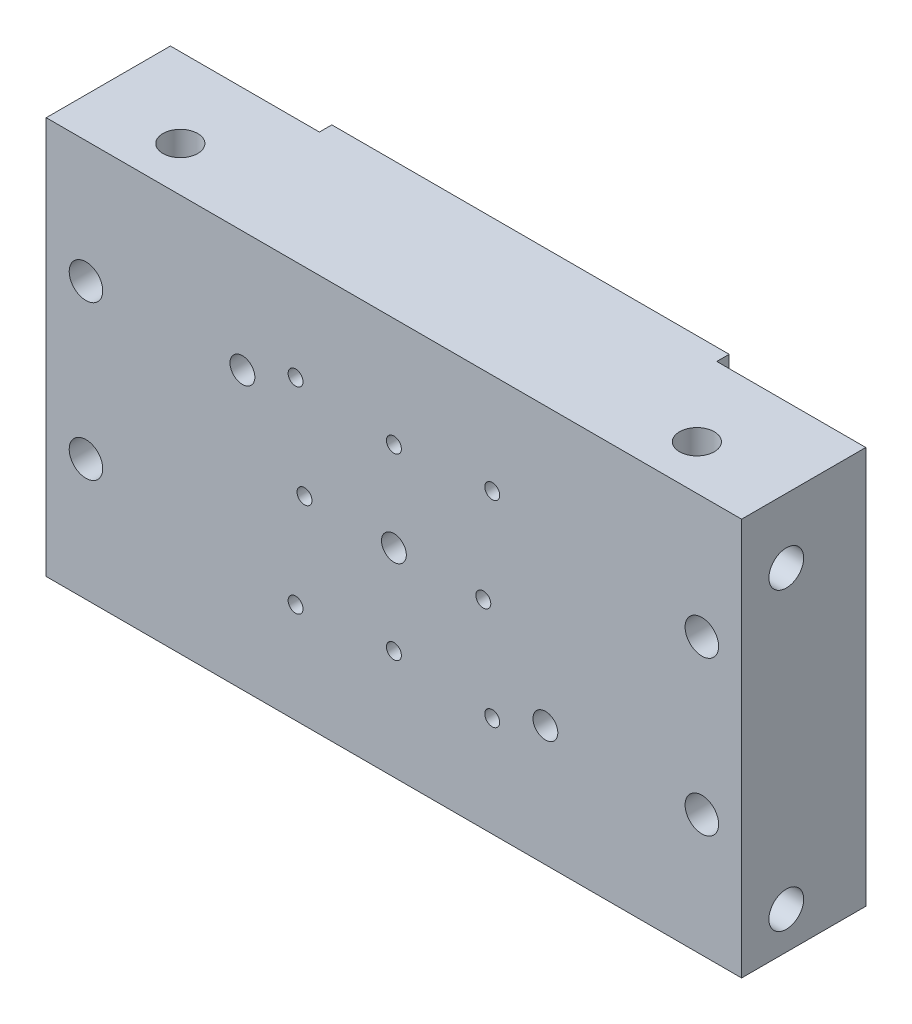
SolidWorks part; units mm, degrees
ref_plane "Plan de face" through (0, 0, 0) normal (0, 0, 1) x (1, 0, 0)
ref_plane "Plan de dessus" through (0, 0, 0) normal (0, 1, 0) x (1, 0, 0)
ref_plane "Plan de droite" through (0, 0, 0) normal (1, 0, 0) x (0, 0, -1)
sketch "Esquisse8" plane through (0, 0, 0) normal (0, 0, 1) x (1, 0, 0)
  line L1 (-70, 40) -> (70, 40)
  line L2 (-70, 40) -> (-70, -40)
  line L3 (-70, -40) -> (70, -40)
  line L4 (70, 40) -> (70, -40)
extrude "Extrusion2" add sketch "Esquisse8" along normal blind 25
sketch "Esquisse9" plane through (0, 0, 0) normal (0, 0, -1) x (-1, 0, 0)
  line L0 (13.0758, -10.1766) -> (20.7809, -17.8817)
  line L1 (16.4419, -2.05) -> (27.3386, -2.05)
  arc A0 (16.4419, -2.05) -> (13.5742, -4.1692) centre (16.4419, -5.05) ccw
  arc A1 (13.0758, -10.1766) -> (12.5464, -6.6503) centre (15.1971, -8.0553) cw
  arc A2 (27.3386, -2.05) -> (31.2441, -6.9143) centre (27.3386, -6.05) cw
  arc A3 (20.7809, -17.8817) -> (26.982, -17.2038) centre (23.6093, -15.0533) ccw
  arc A4 (31.2441, -6.9143) -> (26.982, -17.2038) centre (0, 0) cw
  arc A7 (13.5742, -4.1692) -> (12.5464, -6.6503) centre (0, 0) cw
extrude "Extrusion3" add sketch "Esquisse9" along normal blind 4.5
pattern_circular "Répétition circulaire1" count 8 over 360 about axis through (0, 0, 0) along (0, 0, 1) of "Extrusion3"
sketch "Esquisse10" plane through (0, 0, 0) normal (0, 0, -1) x (-1, 0, 0)
  circle A0 centre (0, 0) radius 3.5119
extrude "Extrusion4" add sketch "Esquisse10" along normal blind 4.5
sketch "Esquisse11" plane through (0, 0, 0) normal (0, 0, -1) x (-1, 0, 0)
  circle A1 centre (0, 8.75) radius 1.2
  dimension "D1" = 2.4
extrude "Extrusion5" add sketch "Esquisse11" along normal blind 2.5
pattern_circular "Répétition circulaire2" count 4 over 360 about axis through (0, 0, 0) along (0, 0, 1) of "Extrusion5"
sketch "Esquisse12" plane through (0, 0, 0) normal (0, 0, -1) x (-1, 0, 0)
  circle A0 centre (0, 8.75) radius 2
  dimension "D1" = 4
extrude "Extrusion6" add sketch "Esquisse12" along normal blind 2
pattern_circular "Répétition circulaire4" count 4 over 360 about axis through (0, 0, 0) along (0, 0, 1) of "Extrusion6"
sketch "Esquisse13" plane through (0, 0, 0) normal (0, 0, -1) x (-1, 0, 0)
  line L0 (-70, 40) -> (70, 40) construction
  line L1 (-40, 40) -> (40, 40)
  line L2 (-40, 40) -> (-40, -40)
  line L3 (-40, -40) -> (40, -40)
  line L4 (40, 40) -> (40, -40)
  line L5 (70, -40) -> (-70, -40) construction
  circle A0 centre (0, 0) radius 14.2
  dimension "D1" = 40
  dimension "D2" = 40
extrude "Extrusion7" add sketch "Esquisse13" along normal blind 2.5
sketch "Esquisse14" plane through (0, 0, -4.5) normal (0, 0, -1) x (-1, 0, 0)
  circle A0 centre (0, 0) radius 2.5
  dimension "D1" = 5
extrude "Extrusion8" cut sketch "Esquisse14" against normal through all
sketch "Esquisse15" plane through (0, 0, -2.5) normal (0, 0, -1) x (-1, 0, 0)
  line L0 (0, 0) -> (28.1088, 28.1088) construction
  line L1 (0, 0) -> (-28.1088, 28.1088) construction
  line L2 (0, 0) -> (-38.1124, 0) construction
  line L3 (0, 0) -> (35.2216, 0) construction
  line L4 (0, 0) -> (-28.1088, -28.1088) construction
  line L5 (0, 0) -> (28.1088, -28.1088) construction
  circle A0 centre (-19.799, -19.799) radius 1.5
  circle A1 centre (-19.799, 19.799) radius 1.5
  circle A2 centre (19.799, 19.799) radius 1.5
  circle A3 centre (19.799, -19.799) radius 1.5
  dimension "D1" = 3
  dimension "D3" = 28
  dimension "D4" = 28
  dimension "D5" = 28
  dimension "D2" = 28
extrude "Extrusion9" cut sketch "Esquisse15" against normal through all
sketch "Esquisse16" plane through (0, 0, -2.5) normal (0, 0, -1) x (-1, 0, 0)
  line L0 (0, 33.9284) -> (0, -32.2548) construction
  line L1 (-32.1787, 0) -> (32.3308, 0) construction
  circle A0 centre (0, 18) radius 1.5
  circle A1 centre (18, 0) radius 1.5
  circle A2 centre (0, -18) radius 1.5
  circle A3 centre (-18, 0) radius 1.5
  dimension "D1" = 3
  dimension "D2" = 18
  dimension "D3" = 18
  dimension "D5" = 18
  dimension "D4" = 18
extrude "Extrusion10" cut sketch "Esquisse16" against normal through all
sketch "Esquisse19" plane through (-70, 0, 0) normal (-1, 0, 0) x (0, 0, 1)
  line L0 (25, 40) -> (0, 40) construction
  line L1 (25, 40) -> (25, -40) construction
  circle A0 centre (16, 27) radius 3
  dimension "D1" = 6
  dimension "D3" = 13
  dimension "D4" = 9
extrude "Extrusion11" cut sketch "Esquisse19" against normal through all
sketch "Esquisse21" plane through (-70, 0, 0) normal (-1, 0, 0) x (0, 0, 1)
  line L0 (25, 40) -> (25, -40) construction
  line L1 (25, -40) -> (0, -40) construction
  circle A0 centre (16, -32.5) radius 3
  dimension "D1" = 6
  dimension "D2" = 9
  dimension "D3" = 7.5
extrude "Extrusion13" cut sketch "Esquisse21" against normal blind 64
mirror "Symétrie2" about plane through (0, 0, 0) normal (1, 0, 0) of "Extrusion13"
sketch "Esquisse23" plane through (0, 40, 0) normal (0, 1, 0) x (1, 0, 0)
  line L0 (-70, -25) -> (-70, 0) construction
  line L1 (70, -25) -> (-70, -25) construction
  circle A0 centre (-52, -16) radius 3
  dimension "D1" = 6
  dimension "D2" = 18
  dimension "D3" = 9
extrude "Extrusion15" cut sketch "Esquisse23" against normal up to surface (72.5 mm away)
mirror "Symétrie3" about plane through (0, 0, 0) normal (1, 0, 0) of "Extrusion15"
sketch "Esquisse25" plane through (0, 0, 0) normal (0, 0, -1) x (-1, 0, 0)
  line L0 (-70, 40) -> (-40, 40) construction
  line L2 (-70, -40) -> (-70, 40) construction
  circle A0 centre (-62, 15.5) radius 3.375
  dimension "D1" = 6.75
  dimension "D3" = 8
  dimension "D2" = 24.5
extrude "Extrusion17" cut sketch "Esquisse25" against normal through all
sketch "Esquisse26" plane through (0, 0, 0) normal (0, 0, -1) x (-1, 0, 0)
  circle A0 centre (-62, 15.5) radius 5.5
  dimension "D1" = 11
extrude "Extrusion18" cut sketch "Esquisse26" against normal blind 6.9
mirror "Symétrie4" about plane through (0, 0, 0) normal (0, 1, 0) of "Extrusion18", "Extrusion17"
mirror "Symétrie5" about plane through (0, 0, 0) normal (1, 0, 0) of "Symétrie4", "Extrusion17", "Extrusion18"
hole_wizard "Trou taraudé M61" positions "Esquisse3D1" profile "Esquisse28" tap size "M6" standard "ISO"
sketch3d "Esquisse3D1"
  point P0 (30.5, -15.75, 25)
  point P2 (-30.5, 15.75, 25)
  dimension "D1" = 30.5
  dimension "D4" = 30.5
  dimension "D2" = 15.75
  dimension "D3" = 15.75
sketch "Esquisse28" plane through (30.5, -15.75, 25) normal (1, 0, 0) x (0, -1, 0)
  line L0 (0, 0) -> (0, 16.5022)
  line L1 (0, 16.5022) -> (2.5, 15)
  line L2 (2.5, 15) -> (2.5, 0)
  line L5 (2.5, 0) -> (0, 0)
  line L10 (0, 16.5022) -> (-2.5, 15) construction
  line L11 (0, -6.35) -> (0, 107.95) construction
  dimension "Diamètre du trou pour taraudage" = 5
  dimension "Profondeur du trou pour taraudage" = 15
  dimension "Angle de pointe" = 118
hole_wizard "Trou taraudé M8x1.03" positions "Esquisse3D4" profile "Esquisse33" tap size "M8x1.0" standard "ISO"
sketch3d "Esquisse3D4"
  line L0 (-6, -32.5, 16) -> (-70, -32.5, 16) construction
  line L1 (-52, 27, 16) -> (-70, 27, 16) construction
  line L2 (-52, 27, 16) -> (-52, 40, 16) construction
  line L3 (52, 27, 16) -> (52, 40, 16) construction
  line L4 (70, 27, 16) -> (52, 27, 16) construction
  line L5 (6, -32.5, 16) -> (70, -32.5, 16) construction
  point P0 (-70, -32.5, 16)
  point P4 (-70, 27, 16)
  point P8 (-52, 40, 16)
  point P12 (52, 40, 16)
  point P16 (70, 27, 16)
  point P20 (70, -32.5, 16)
sketch "Esquisse33" plane through (-70, -32.5, 16) normal (0, 1, 0) x (0, 0, 1)
  line L0 (0, 0) -> (0, 23.103)
  line L1 (0, 23.103) -> (3.5, 21)
  line L2 (3.5, 21) -> (3.5, 0)
  line L5 (3.5, 0) -> (0, 0)
  line L10 (0, 23.103) -> (-3.5, 21) construction
  line L11 (0, -6.35) -> (0, 107.95) construction
  dimension "Diamètre du trou pour taraudage" = 7
  dimension "Profondeur du trou pour taraudage" = 21
  dimension "Angle de pointe" = 118
